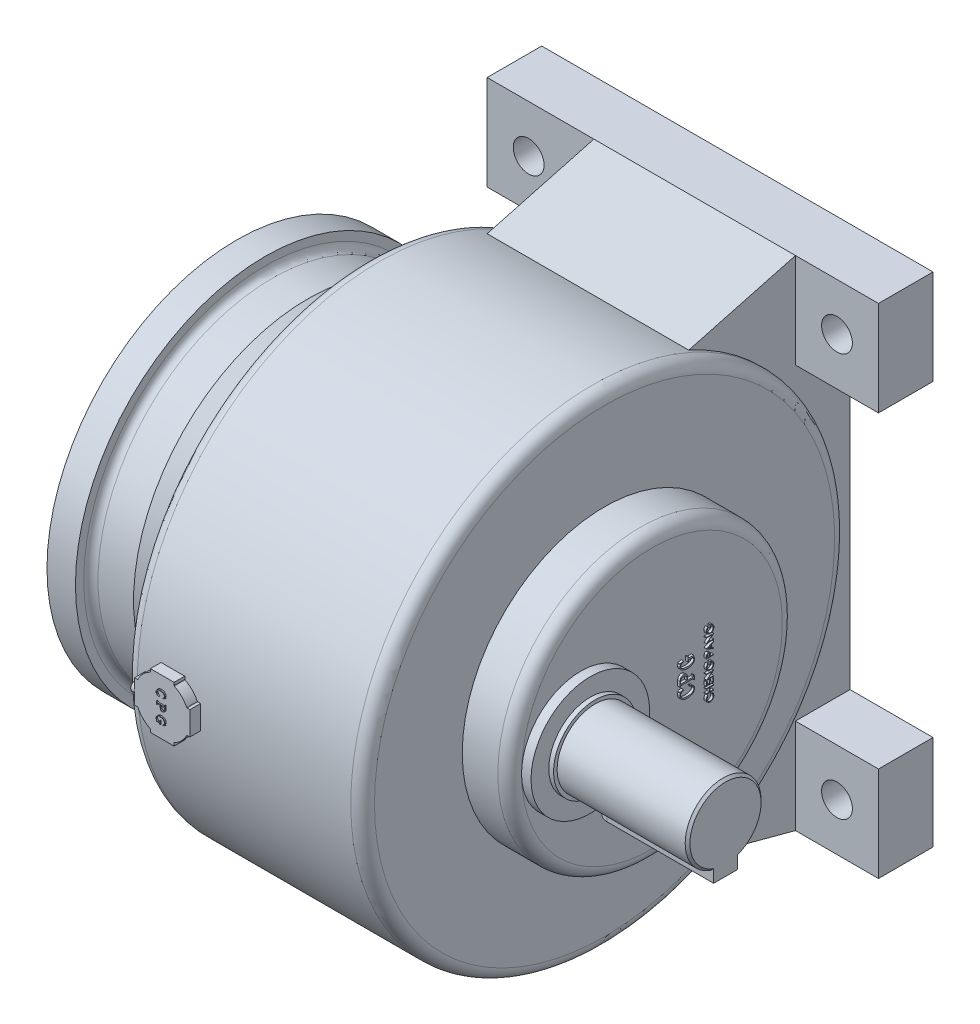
SolidWorks part; units mm, degrees
ref_plane "前视基准面" through (0, 0, 0) normal (0, 0, 1) x (1, 0, 0)
ref_plane "上视基准面" through (0, 0, 0) normal (0, 1, 0) x (1, 0, 0)
ref_plane "右视基准面" through (0, 0, 0) normal (1, 0, 0) x (0, 0, -1)
ref_plane "基准面1" through (0, 0, -140) normal (0, 0, 1) x (1, 0, 0)
sketch "草图1" plane through (0, 0, 0) normal (0, 1, 0) x (1, 0, 0)
  line L0 (0, 0) -> (33.1729, 0) construction
  line L1 (0, 0) -> (0, -16)
  line L2 (0, -16) -> (-55, -16)
  line L3 (-55, -16) -> (-55, -17.5)
  line L4 (-55, -17.5) -> (-57, -17.5)
  line L5 (-57, -17.5) -> (-57, -25)
  line L6 (-57, -25) -> (-61, -25)
  line L7 (-61, -25) -> (-61, 0)
  line L8 (-61, 0) -> (0, 0)
  dimension "D1" = 55
  dimension "D2" = 32
  dimension "D3" = 35
  dimension "D4" = 2
  dimension "D5" = 50
  dimension "D6" = 4
revolve "旋转1" add sketch "草图1" angle 360 about L0
sketch "草图2" plane through (0, 0, 0) normal (0, 1, 0) x (1, 0, 0)
  line L0 (8.0167, 30) -> (-61, 30) construction
  line L1 (-61, 30) -> (-61, -30)
  line L2 (-61, 25) -> (-61, -25) construction
  line L3 (-61, -30) -> (-81, -30)
  line L4 (-81, -30) -> (-81, -72)
  line L5 (-81, -72) -> (-181, -72)
  line L6 (-181, -72) -> (-181, 30)
  line L11 (-61, 30) -> (-181, 30)
  line L13 (-103.125, 140) -> (103.125, 140) construction
  dimension "D1" = 30
  dimension "D2" = 120
  dimension "D3" = 20
  dimension "D4" = 212
  dimension "D5" = 100
revolve "旋转2" add sketch "草图2" angle 360 about L0
sketch "草图3" plane through (0, 0, -140) normal (0, 0, 1) x (1, 0, 0)
  line L0 (0, 0) -> (40.0459, 0) construction
  line L1 (-217.5, -65) -> (-52.5, -65)
  line L2 (-217.5, -65) -> (-217.5, -105)
  line L3 (-217.5, -105) -> (-52.5, -105)
  line L4 (-52.5, -65) -> (-52.5, -105)
  line L5 (0, -16) -> (0, 16) construction
  circle A0 centre (-70, -85) radius 6.5
  circle A1 centre (-200, -85) radius 6.5
  dimension "D2" = 170
  dimension "D3" = 13
  dimension "D4" = 130
  dimension "D6" = 70
  dimension "D8" = 40
  dimension "D1" = 210
  dimension "D5" = 165
  dimension "D7" = 17.5
extrude "拉伸2" add sketch "草图3" along normal blind 23
mirror "镜向2" about plane through (0, 0, 0) normal (0, 1, 0)
ref_plane "基准面4" through (-130, 0, 0) normal (1, 0, 0) x (0, 0, -1)
sketch "草图4" plane through (-130, 0, 0) normal (1, 0, 0) x (0, 0, -1)
  line L0 (117, 65) -> (140, 65) construction
  line L1 (117, 65) -> (140, 65)
  line L2 (117, 105) -> (117, 65) construction
  line L3 (117, 105) -> (117, 65)
  line L4 (117, -65) -> (140, -65) construction
  line L5 (117, -65) -> (140, -65)
  line L6 (117, -105) -> (117, -65) construction
  line L7 (117, -105) -> (117, -65)
  line L8 (140, 65) -> (140, -65)
  line L9 (117, 105) -> (72, 92.9516)
  line L11 (72, -92.9516) -> (117, -105)
  arc A1 (72, -92.9516) -> (72, 92.9516) centre (30, 0) ccw
  circle A2 centre (30, 0) radius 102 construction
  dimension "D1" = 45
extrude "拉伸3" add sketch "草图4" against normal mid plane 85
sketch "草图5" plane through (0, 0, 0) normal (0, 1, 0) x (1, 0, 0)
  line L0 (0, -5) -> (-45, -5)
  line L1 (0, -16) -> (0, 16) construction
  line L2 (-45, 5) -> (0, 5)
  line L3 (0, 5) -> (0, -5)
  line L4 (35.5, -13.7955) -> (35.5, 19.6443) construction
  arc A0 (-45, -5) -> (-45, 5) centre (-45, 0) cw
  dimension "D2" = 50
  dimension "D1" = 10
  dimension "D3" = 35.5
extrude "拉伸4" add sketch "草图5" against normal blind 19.5
fillet "圆角1" radius 5 3 edges at (-181, 0, -132) (-81, 0, -132) (-61, 0, -90)
chamfer "倒角1" distance 1 angle 45 1 edges at (0, 16, 0)
sketch "草圖1" plane through (0, 0, 0) normal (0, 1, 0) x (1, 0, 0)
  line L1 (-231.9137, 79.8975) -> (-232, 79.9966)
  line L9 (-236, 109.9095) -> (-236, 85.9095)
  line L10 (-235, 84.9095) -> (-232, 84.9095)
  line L11 (-232, 84.9095) -> (-232, 79.9966)
  line L12 (-231.9137, 79.8975) -> (-211, 76.9964)
  line L13 (-211, 69.4701) -> (-211, 63.9095)
  line L14 (-214, 60.9095) -> (-229, 60.9095)
  line L15 (-230, 50.9095) -> (-228.8, 50.9095)
  line L16 (-230, 59.9095) -> (-230, 50.9095)
  line L17 (-228.5, 50.6095) -> (-228.5, 29.9095)
  line L26 (-65.3592, 29.9095) -> (-237.5963, 29.9095) construction
  line L27 (-181, 29.9095) -> (-228.5, 29.9095)
  line L28 (-181, 90.9095) -> (-181, 29.9095)
  line L29 (-181, 90.9095) -> (-186, 90.9095)
  line L30 (-186, 90.9095) -> (-206, 103.4095)
  line L31 (-206, 103.4095) -> (-221, 103.4095)
  line L32 (-224, 106.4095) -> (-224, 109.9095)
  line L33 (-224, 109.9095) -> (-236, 109.9095)
  line L34 (19.9234, -0.0905) -> (-221.4481, -0.0905) construction
  arc A6 (-236, 85.9095) -> (-235, 84.9095) centre (-235, 85.9095) ccw
  arc A7 (-209.7461, 71.9096) -> (-211, 76.9964) centre (-211.3875, 74.2029) ccw
  arc A8 (-209.7461, 71.9096) -> (-211, 69.4701) centre (-208, 69.4701) ccw
  arc A9 (-214, 60.9095) -> (-211, 63.9095) centre (-214, 63.9095) ccw
  arc A10 (-229, 60.9095) -> (-230, 59.9095) centre (-229, 59.9095) ccw
  arc A11 (-228.5, 50.6095) -> (-228.8, 50.9095) centre (-228.8, 50.6095) ccw
  arc A13 (-224, 106.4095) -> (-221, 103.4095) centre (-221, 106.4095) ccw
  dimension "D1" = 30
  dimension "D2" = 160
  dimension "D3" = 110
  dimension "D4" = 55
revolve "旋轉1" add sketch "草圖1" angle 360 about L26
sketch "草圖2" plane through (-236, 0, 0) normal (-1, 0, 0) x (0, 0, 1)
  line L0 (-114.004, 0) -> (58.9193, 0) construction
  line L1 (-29.9095, 84.2191) -> (-29.9095, -84.9666) construction
  circle A0 centre (-29.9095, 0) radius 65 construction
  circle A1 centre (-75.8714, 45.9619) radius 4
  circle A2 centre (16.0524, 45.9619) radius 4
  circle A3 centre (16.0524, -45.9619) radius 4
  circle A4 centre (-75.8714, -45.9619) radius 4
  dimension "D1" = 130
  dimension "D2" = 8
extrude "伸長1" cut sketch "草圖2" against normal blind 25
sketch "草圖3" plane through (-236, 0, 0) normal (-1, 0, 0) x (0, 0, 1)
  line L0 (-29.9147, 0) -> (-96.1785, 0) construction
  line L1 (-91.0481, 25.778) -> (-71.3442, 5.5251)
  line L2 (-91.0481, -25.2495) -> (-71.2803, -5.4747)
  line L3 (-70.3388, 10.7256) -> (-77.4099, 17.7967)
  line L4 (-47.7114, 47.4952) -> (-40.6403, 40.4241)
  line L5 (-76.6713, 35.0893) -> (-65.004, 46.7566)
  line L6 (-55.6928, 61.1334) -> (-35.918, 41.3656)
  line L7 (-4.6652, 61.1334) -> (-24.9182, 41.4295)
  line L8 (4.646, 46.7566) -> (16.3133, 35.0893)
  line L10 (17.0519, 17.7967) -> (9.9808, 10.7256)
  line L11 (30.6901, 25.778) -> (10.9223, 6.0033)
  line L12 (30.6901, -25.2495) -> (10.9862, -4.9966)
  line L13 (16.3133, -34.5607) -> (4.646, -46.228)
  line L15 (-12.6466, -46.9666) -> (-19.7177, -39.8955)
  line L16 (-4.6652, -60.6048) -> (-24.44, -40.837)
  line L17 (-55.6928, -60.6048) -> (-35.4398, -40.9009)
  line L18 (-65.004, -46.228) -> (-76.6713, -34.5607)
  line L20 (-77.4099, -17.2681) -> (-70.3388, -10.197)
  line L22 (-19.7177, 40.4241) -> (-12.6466, 47.4952)
  line L24 (9.9808, -10.197) -> (17.0519, -17.2681)
  line L29 (-40.6403, -39.8955) -> (-47.7114, -46.9666)
  arc A0 (-91.0481, 25.778) -> (-91.0481, -25.2495) centre (-30.179, 0.2643) ccw
  arc A1 (-40.6403, 40.4241) -> (-70.3388, 10.7256) centre (-30.179, 0.2643) ccw
  arc A2 (9.9808, 10.7256) -> (-19.7177, 40.4241) centre (-30.179, 0.2643) ccw
  arc A3 (-71.3442, 5.5251) -> (-71.2803, -5.4747) centre (-30.179, 0.2643) ccw
  arc A4 (-4.6652, 61.1334) -> (-55.6928, 61.1334) centre (-30.179, 0.2643) ccw
  arc A5 (-24.9182, 41.4295) -> (-35.918, 41.3656) centre (-30.179, 0.2643) ccw
  arc A6 (-19.7177, -39.8955) -> (9.9808, -10.197) centre (-30.179, 0.2643) ccw
  arc A7 (30.6901, -25.2495) -> (30.6901, 25.778) centre (-30.179, 0.2643) ccw
  arc A8 (10.9862, -4.9966) -> (10.9223, 6.0033) centre (-30.179, 0.2643) ccw
  arc A9 (-70.3388, -10.197) -> (-40.6403, -39.8955) centre (-30.179, 0.2643) ccw
  arc A10 (-55.6928, -60.6048) -> (-4.6652, -60.6048) centre (-30.179, 0.2643) ccw
  arc A11 (-35.4398, -40.9009) -> (-24.44, -40.837) centre (-30.179, 0.2643) ccw
  spline S0 degree 2 poles (-77.4099, 17.7967) (-82.2503, 26.6584) (-76.6713, 35.0893) knots 0 0 0 1 1 1
  spline S1 degree 2 poles (-47.7114, 47.4952) (-56.5731, 52.3355) (-65.004, 46.7566) knots 0 0 0 1 1 1
  spline S2 degree 2 poles (17.0519, 17.7967) (21.8922, 26.6584) (16.3133, 35.0893) knots 0 0 0 1 1 1
  spline S3 degree 2 poles (-12.6466, 47.4952) (-3.7849, 52.3355) (4.646, 46.7566) knots 0 0 0 1 1 1
  spline S4 degree 2 poles (-12.6466, -46.9666) (-3.7849, -51.807) (4.646, -46.228) knots 0 0 0 1 1 1
  spline S5 degree 2 poles (17.0519, -17.2681) (21.8922, -26.1298) (16.3133, -34.5607) knots 0 0 0 1 1 1
  spline S6 degree 2 poles (-77.4099, -17.2681) (-82.2503, -26.1298) (-76.6713, -34.5607) knots 0 0 0 1 1 1
  spline S7 degree 2 poles (-47.7114, -46.9666) (-56.5731, -51.807) (-65.004, -46.228) knots 0 0 0 1 1 1
extrude "伸長2" cut sketch "草圖3" against normal blind 39 draft 1
sketch "草圖4" plane through (-197, 0, 0) normal (-1, 0, 0) x (0, 0, 1)
  circle A0 centre (-29.9095, 0) radius 51.5 construction
  circle A1 centre (-66.3255, 36.416) radius 3
  circle A2 centre (6.5065, 36.416) radius 3
  circle A3 centre (6.5065, -36.416) radius 3
  circle A4 centre (-66.3255, -36.416) radius 3
  dimension "D1" = 103
  dimension "D2" = 6
extrude "伸長3" cut sketch "草圖4" against normal blind 11
sketch "草圖5" plane through (-228.5, 0, 0) normal (-1, 0, 0) x (0, 0, 1)
  line L0 (-29.9106, -23.7231) -> (-29.9106, 30.1834) construction
  line L1 (-20.6106, -2.5) -> (-20.6106, 2.5)
  line L2 (-20.6106, -2.5) -> (-23.3723, -2.5)
  line L4 (-20.6106, 2.5) -> (-23.3723, 2.5)
  line L5 (-54.1952, 0) -> (-3.9485, 0) construction
  circle A0 centre (-29.9106, 0) radius 12.5 construction
  arc A2 (-23.3723, 2.5) -> (-23.3723, -2.5) centre (-29.9106, 0) ccw
  dimension "D1" = 25
  dimension "D2" = 5
  dimension "D5" = 14
  dimension "D4" = 9.3
extrude "伸長4" cut sketch "草圖5" against normal blind 28
sketch "草圖6" plane through (-228.5, 0, 0) normal (-1, 0, 0) x (0, 0, 1)
  line L0 (-20.6106, -2.5) -> (-20.6106, 2.5) construction
  line L1 (-20.6106, -2.5) -> (-23.3723, -2.5) construction
  line L2 (-20.6106, 2.5) -> (-23.3723, 2.5) construction
  line L3 (-20.6106, -2.5) -> (-20.6106, 2.5)
  line L4 (-20.6106, -2.5) -> (-23.3723, -2.5)
  line L5 (-20.6106, 2.5) -> (-23.3723, 2.5)
  arc A0 (-23.3723, 2.5) -> (-23.3723, -2.5) centre (-29.9106, 0) ccw construction
  circle A1 centre (-29.9106, 0) radius 12.5 construction
  arc A2 (-23.3723, 2.5) -> (-23.3723, -2.5) centre (-29.9106, 0) ccw
  circle A3 centre (-29.9106, 0) radius 12.5
extrude "伸長5" add sketch "草圖6" along normal blind 1
sketch "草圖12"
extrude "伸長10" add sketch "草圖12" along normal blind 1
ref_plane "平面1" through (0, 0, 76.5) normal (0, 0, 1) x (1, 0, 0)
sketch "草圖7" plane through (0, 0, 76.5) normal (0, 0, 1) x (1, 0, 0)
  line L0 (-166, 11.65) -> (-156, 11.65)
  line L1 (-166, 11.65) -> (-166, 10.5119)
  line L2 (-156, 11.65) -> (-156, 10.5119)
  line L3 (-166, -10.5119) -> (-166, -11.65)
  line L4 (-156, -10.5119) -> (-156, -11.65)
  line L5 (-172.65, 5) -> (-171.5119, 5)
  line L6 (-172.65, -5) -> (-171.5119, -5)
  line L7 (-172.65, -5) -> (-172.65, 5)
  line L8 (-166, -11.65) -> (-166, -10.5119)
  line L9 (-156, -11.65) -> (-156, -10.5119)
  line L10 (-156, -11.65) -> (-166, -11.65)
  line L11 (-149.35, -5) -> (-150.4881, -5)
  line L12 (-149.35, 5) -> (-150.4881, 5)
  line L13 (-149.35, 5) -> (-149.35, -5)
  arc A0 (-166.1383, 10.2882) -> (-171.2882, 5.1383) centre (-161, 0) ccw
  arc A1 (-166.1383, 10.2882) -> (-166, 10.5119) centre (-166.25, 10.5119) ccw
  arc A2 (-156, 10.5119) -> (-155.8617, 10.2882) centre (-155.75, 10.5119) ccw
  arc A3 (-171.5119, 5) -> (-171.2882, 5.1383) centre (-171.5119, 5.25) ccw
  arc A4 (-171.2882, -5.1383) -> (-171.5119, -5) centre (-171.5119, -5.25) ccw
  arc A5 (-166, -10.5119) -> (-166.1383, -10.2882) centre (-166.25, -10.5119) ccw
  arc A6 (-155.8617, -10.2882) -> (-156, -10.5119) centre (-155.75, -10.5119) ccw
  arc A7 (-150.4881, -5) -> (-150.7118, -5.1383) centre (-150.4881, -5.25) ccw
  arc A8 (-150.7118, 5.1383) -> (-150.4881, 5) centre (-150.4881, 5.25) ccw
  arc A9 (-150.7118, 5.1383) -> (-155.8617, 10.2882) centre (-161, 0) ccw
  arc A10 (-171.2882, -5.1383) -> (-166.1383, -10.2882) centre (-161, 0) ccw
  arc A11 (-155.8617, -10.2882) -> (-150.7118, -5.1383) centre (-161, 0) ccw
  dimension "D1" = 11.5
extrude "伸長6" add sketch "草圖7" against normal blind 4.5 separate body contours A6 A11 A7 L11 L13 L12 A8 A9 A2 L2 L0 L1 A1 A0 A3 L5 L7 L6 A4 A10 A5 L3 L10 L4
sketch "草圖8"
extrude "伸長7" add sketch "草圖8" along normal blind 0.5
sketch "草圖9" plane through (0, 0, 0) normal (0, 1, 0) x (1, 0, 0)
  line L0 (-174.5404, -74.25) -> (-166.5404, -74.25)
  line L1 (-174.5404, -74.25) -> (-174.5404, -72.25)
  line L2 (-173.0404, -73) -> (-173.0404, -72.25)
  line L3 (-115.5, -76.5) -> (115.5, -76.5) construction
  line L13 (-171.0404, -73) -> (-166.5404, -73.25)
  line L15 (-173.0404, -73) -> (-171.0404, -73)
  line L23 (-174.5404, -72.25) -> (-173.0404, -72.25)
  line L24 (-171.0404, -74.25) -> (-171.0404, -73)
  line L25 (-166.5404, -74.25) -> (-166.5404, -73.25)
  dimension "D1" = 2.25
revolve "旋轉2" add sketch "草圖9" angle 360 about L0
equation "\"D3@草图1\" = \"D2@草图1\"+3"
equation "\"D1@拉伸4\" = \"D3@草图5\"-\"D2@草图1\"/2"
equation "\"D5@草图2\" = \"D4@草图3\"-30"
equation "\"D7@草图3\" =( \"D5@草图3\"-\"D4@草图3\")/2"
equation "\"D8@草图3\" = \"D1@草图3\"-\"D2@草图3\""
equation "\"D1@基准面4\" = \"D5@草图3\"/2-5"
equation "\"D1@拉伸3\" = \"D4@草图3\"-\"D3@草图3\"-32"
